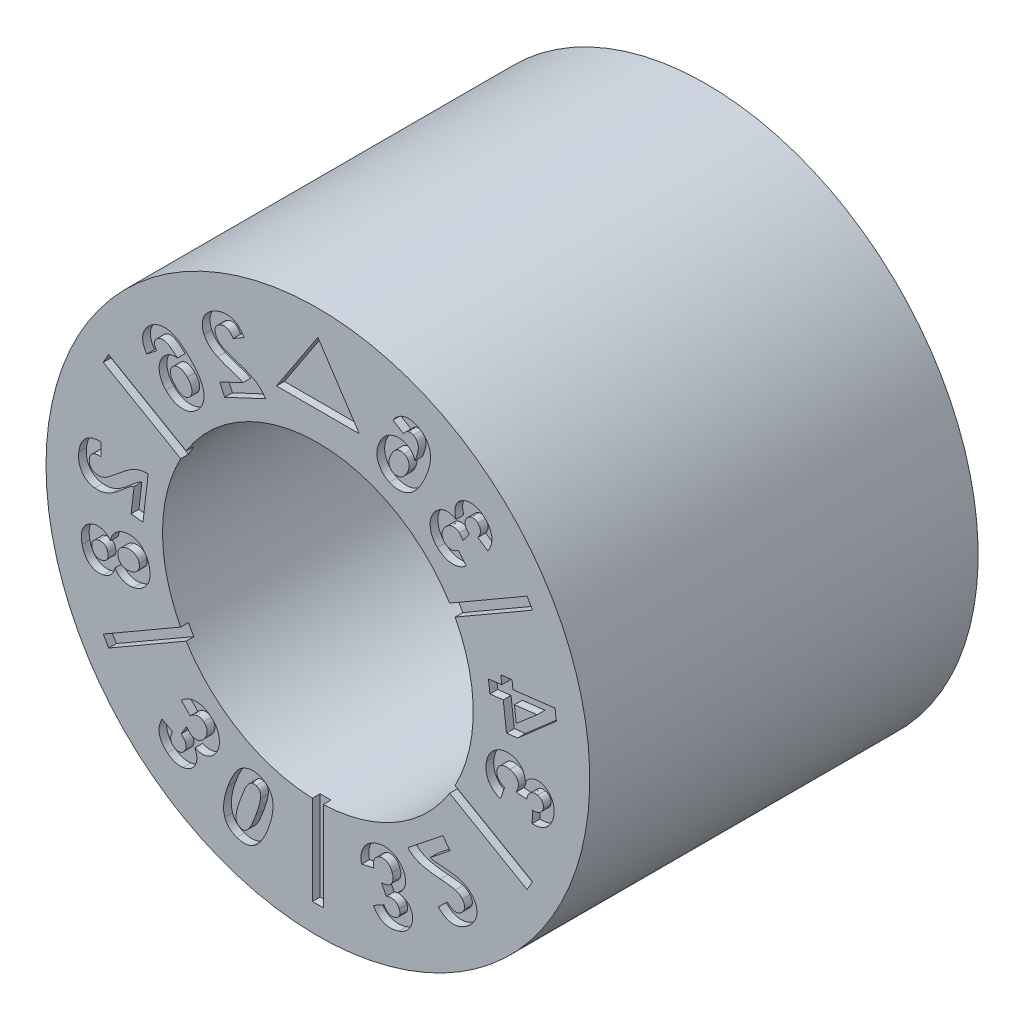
SolidWorks part; units mm, degrees
ref_plane "Front Plane" through (0, 0, 0) normal (0, 0, 1) x (1, 0, 0)
ref_plane "Top Plane" through (0, 0, 0) normal (0, 1, 0) x (1, 0, 0)
ref_plane "Right Plane" through (0, 0, 0) normal (1, 0, 0) x (0, 0, -1)
imported_body "Imported1"
other "Move Face1" parameters "D1"=0.22
other "DeleteFace2"
sketch "Sketch1" plane through (0, 0, 0) normal (0, 0, 1) x (1, 0, 0)
  line L0 (0, 0) -> (0, -3.9447) construction
  line L2 (-0.07, -1.65) -> (0.07, -1.65)
  line L3 (-0.07, -1.65) -> (-0.07, -3.15)
  line L4 (-0.07, -3.15) -> (0.07, -3.15)
  line L5 (0.07, -1.65) -> (0.07, -3.15)
  line L9 (0, 0) -> (-1.9723, -3.4162) construction
  line L10 (-1.4639, -0.7644) -> (-1.3939, -0.8856)
  line L11 (-1.3939, -0.8856) -> (-2.693, -1.6356)
  line L12 (-1.4639, -0.7644) -> (-2.763, -1.5144)
  line L13 (-2.763, -1.5144) -> (-2.693, -1.6356)
  line L14 (0, 0) -> (-3.4162, -1.9723) construction
  line L19 (0, 0) -> (-3.9447, 0) construction
  line L20 (-1.3939, 0.8856) -> (-1.4639, 0.7644)
  line L21 (-1.4639, 0.7644) -> (-2.763, 1.5144)
  line L22 (-1.3939, 0.8856) -> (-2.693, 1.6356)
  line L23 (-2.693, 1.6356) -> (-2.763, 1.5144)
  line L24 (0, 0) -> (-3.4162, 1.9723) construction
  line L29 (0, 0) -> (-1.9723, 3.4162) construction
  line L34 (0, 0) -> (0, 3.9447) construction
  line L39 (0, 0) -> (1.9723, 3.4162) construction
  line L40 (1.4639, 0.7644) -> (1.3939, 0.8856)
  line L41 (1.3939, 0.8856) -> (2.693, 1.6356)
  line L42 (1.4639, 0.7644) -> (2.763, 1.5144)
  line L43 (2.763, 1.5144) -> (2.693, 1.6356)
  line L44 (0, 0) -> (3.4162, 1.9723) construction
  line L49 (0, 0) -> (3.9447, 0) construction
  line L50 (1.3939, -0.8856) -> (1.4639, -0.7644)
  line L51 (1.4639, -0.7644) -> (2.763, -1.5144)
  line L52 (1.3939, -0.8856) -> (2.693, -1.6356)
  line L53 (2.693, -1.6356) -> (2.763, -1.5144)
  line L54 (0, 0) -> (3.4162, -1.9723) construction
  line L59 (0, 0) -> (1.9723, -3.4162) construction
  line L60 (0.07, 3.15) -> (-0.07, 3.15)
  line L61 (0.07, 1.65) -> (0.07, 3.15)
  line L62 (-0.07, 1.65) -> (-0.07, 3.15)
  line L63 (0.07, 1.65) -> (-0.07, 1.65)
  line L64 (-0.7644, 1.4639) -> (-1.5144, 2.763)
  line L65 (-1.5144, 2.763) -> (-1.6356, 2.693)
  line L66 (-0.8856, 1.3939) -> (-1.6356, 2.693)
  line L67 (-0.7644, 1.4639) -> (-0.8856, 1.3939)
  line L68 (0.8856, 1.3939) -> (1.6356, 2.693)
  line L69 (0.8856, 1.3939) -> (0.7644, 1.4639)
  line L70 (0.7644, 1.4639) -> (1.5144, 2.763)
  line L71 (-1.65, 0.07) -> (-3.15, 0.07)
  line L72 (-1.65, -0.07) -> (-3.15, -0.07)
  line L73 (-3.15, 0.07) -> (-3.15, -0.07)
  line L74 (-1.65, 0.07) -> (-1.65, -0.07)
  line L75 (1.65, 0.07) -> (3.15, 0.07)
  line L76 (3.15, -0.07) -> (3.15, 0.07)
  line L77 (1.65, -0.07) -> (3.15, -0.07)
  line L78 (1.65, -0.07) -> (1.65, 0.07)
  line L79 (-0.7644, -1.4639) -> (-1.5144, -2.763)
  line L80 (-0.8856, -1.3939) -> (-1.6356, -2.693)
  line L81 (-1.6356, -2.693) -> (-1.5144, -2.763)
  line L82 (-0.8856, -1.3939) -> (-0.7644, -1.4639)
  line L83 (0.8856, -1.3939) -> (1.6356, -2.693)
  line L84 (0.7644, -1.4639) -> (1.5144, -2.763)
  line L85 (0.7644, -1.4639) -> (0.8856, -1.3939)
  line L86 (1.5144, -2.763) -> (1.6356, -2.693)
  line L87 (1.6356, 2.693) -> (1.5144, 2.763)
  arc A0 (-0.6463, 2.1656) -> (0, 2.26) centre (0, 0) ccw construction
  text T0 "26  28  30  32  34  36" font "Arial" height 0.87
  point P66 (0, 0)
  dimension "D1" = 4.52
  dimension "D6" = 12
extrude "Cut-Extrude1" cut sketch "Sketch1" against normal blind 0.1
